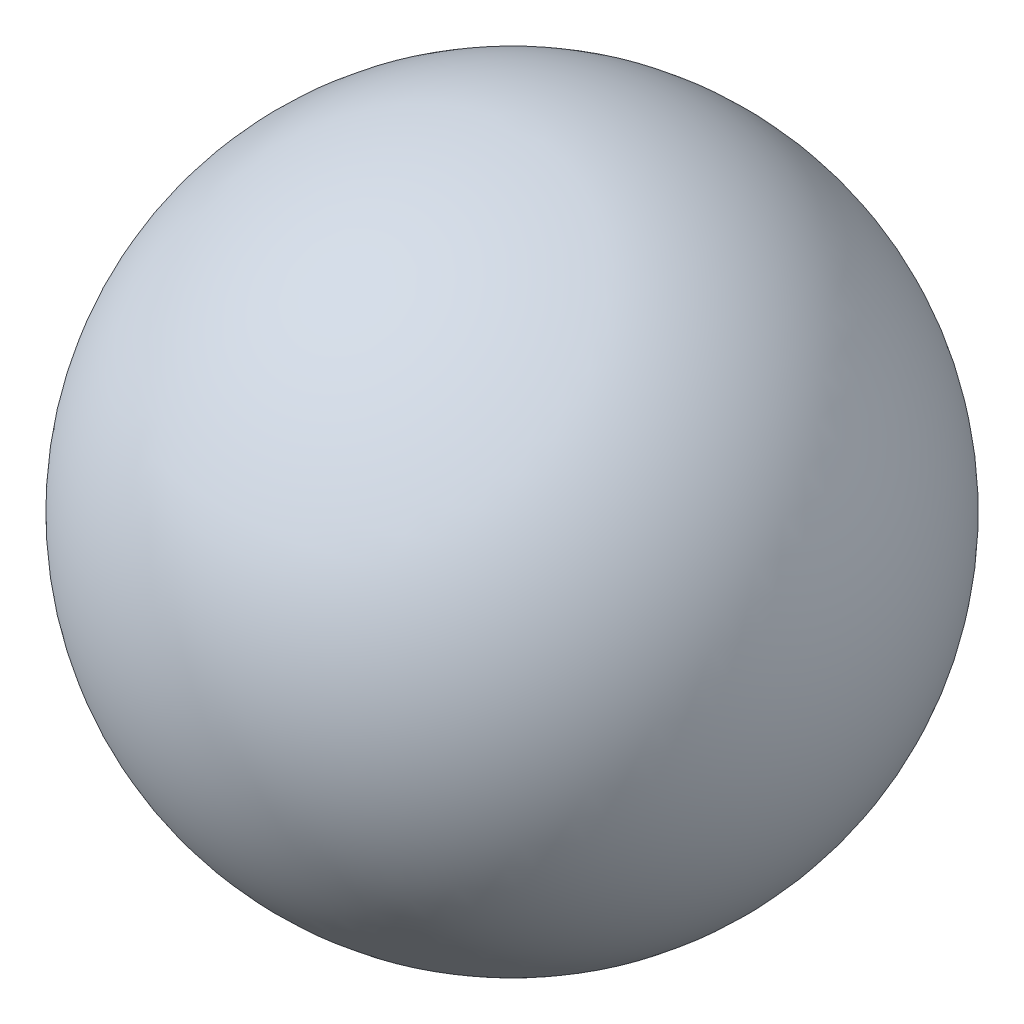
SolidWorks part; units mm, degrees
ref_plane "Front" through (0, 0, 0) normal (0, 0, 1) x (1, 0, 0)
ref_plane "Top" through (0, 0, 0) normal (0, 1, 0) x (1, 0, 0)
ref_plane "Right" through (0, 0, 0) normal (1, 0, 0) x (0, 0, -1)
sketch "Sketch1" plane through (0, 0, 0) normal (0, 0, 1) x (1, 0, 0)
  line L0 (0, 32.512) -> (0, -32.512)
  arc A0 (0, -32.512) -> (0, 32.512) centre (0, 0) ccw
  dimension "D1" = 65.024
revolve "Revolve4" add sketch "Sketch1" angle 360 about L0
